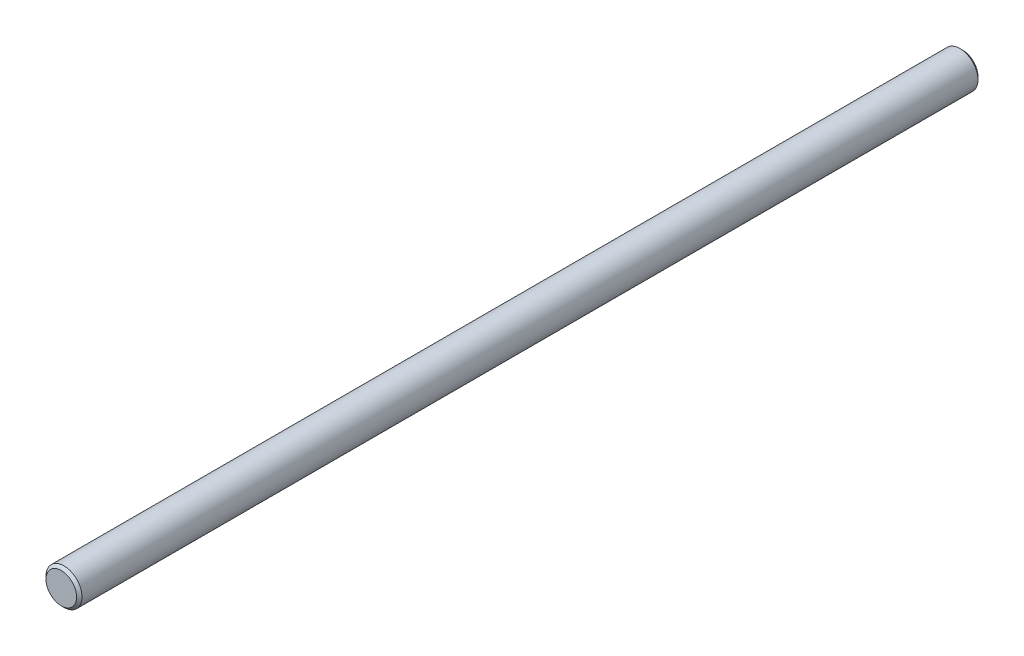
SolidWorks part; units mm, degrees
ref_plane "Plan de face" through (0, 0, 0) normal (0, 0, 1) x (1, 0, 0)
ref_plane "Plan de dessus" through (0, 0, 0) normal (0, 1, 0) x (1, 0, 0)
ref_plane "Plan de droite" through (0, 0, 0) normal (1, 0, 0) x (0, 0, -1)
sketch "Esquisse1" plane through (0, 0, 0) normal (0, 0, 1) x (1, 0, 0)
  circle A0 centre (0, 0) radius 2
  dimension "D1" = 4
extrude "Extrusion1" add sketch "Esquisse1" along normal blind 100
chamfer "Chanfrein1" distance 0.3 angle 45 1 edges at (2, 0, 100)
chamfer "Chanfrein2" distance 0.3 angle 45 1 edges at (2, 0, 0)
